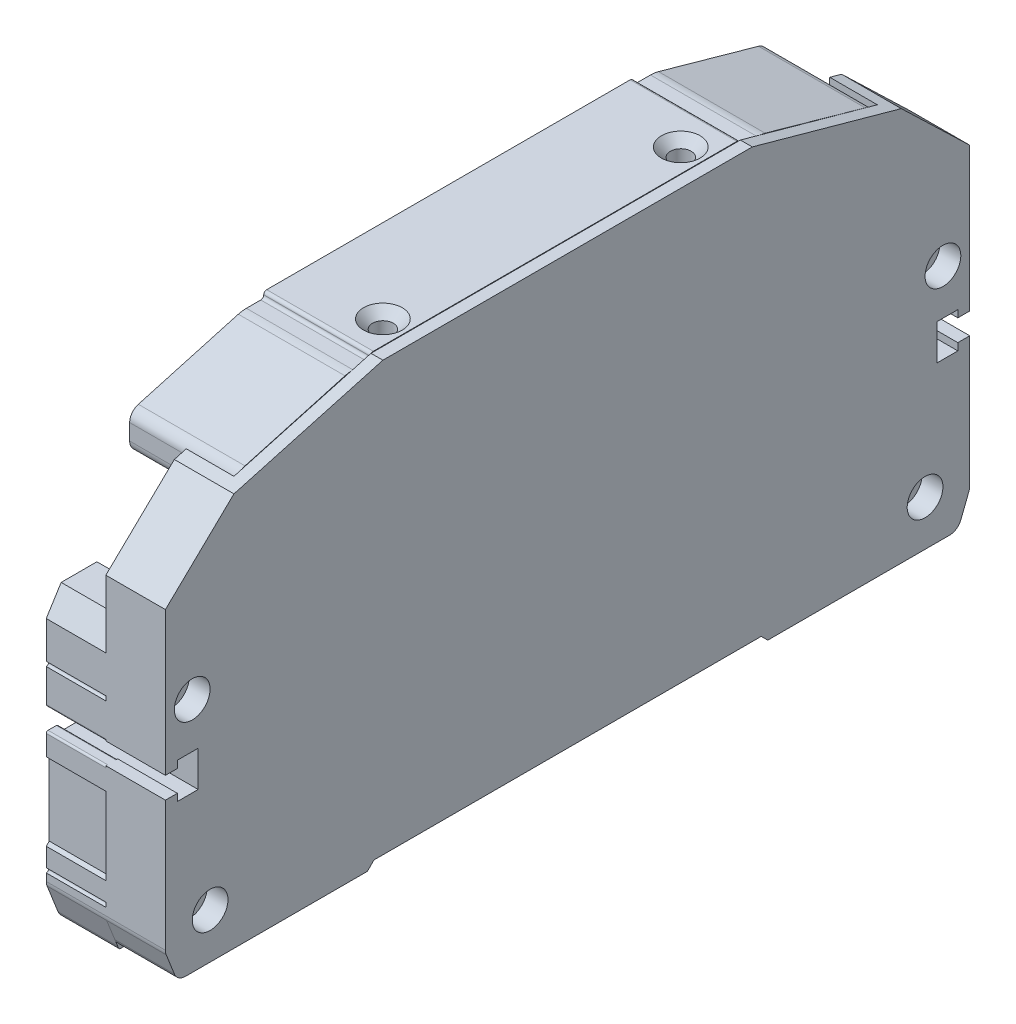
SolidWorks part; units mm, degrees
ref_plane "前视基准面" through (0, 0, 0) normal (0, 0, 1) x (1, 0, 0)
ref_plane "上视基准面" through (0, 0, 0) normal (0, 1, 0) x (1, 0, 0)
ref_plane "右视基准面" through (0, 0, 0) normal (1, 0, 0) x (0, 0, -1)
imported_body "输入1"
sketch "草图1" plane through (0, 0, 0) normal (0, -1, 0) x (1, 0, 0)
  line L0 (149, 64.1333) -> (149, 33.6) construction
  line L1 (129, 101.0619) -> (-243.6144, 101.0619)
  line L2 (129, 101.0619) -> (129, -128.1803)
  line L3 (129, -128.1803) -> (-243.6144, -128.1803)
  line L4 (-243.6144, 101.0619) -> (-243.6144, -128.1803)
  dimension "D1" = 20
extrude "切除-拉伸1" cut sketch "草图1" against normal through all both and the other way through all
